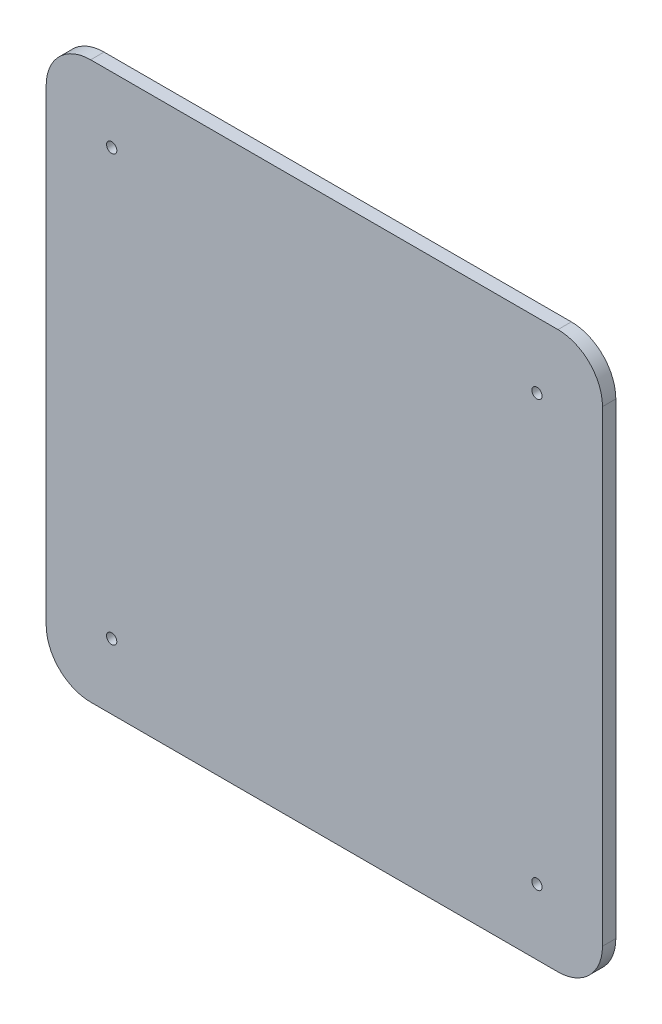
SolidWorks part; units mm, degrees
ref_plane "Alzado" through (0, 0, 0) normal (0, 0, 1) x (1, 0, 0)
ref_plane "Planta" through (0, 0, 0) normal (0, 1, 0) x (1, 0, 0)
ref_plane "Vista lateral" through (0, 0, 0) normal (1, 0, 0) x (0, 0, -1)
sketch "Croquis1" plane through (0, 0, 0) normal (0, 0, 1) x (1, 0, 0)
  line L1 (125, 0) -> (0, 0) construction
  line L2 (125, 0) -> (125, 125) construction
  line L5 (125, 125) -> (0, 125)
  line L17 (125, 0) -> (125, 125) construction
  line L147 (125, 0) -> (125, 125)
  line L153 (0, 125) -> (0, 0)
  line L163 (0, 0) -> (125, 0) construction
  line L165 (0, 0) -> (125, 0)
  dimension "width" = 125
extrude "Saliente-Extruir1" add sketch "Croquis1" along normal blind 3
sketch "Croquis2" plane through (0, 0, 3) normal (0, 0, 1) x (1, 0, 0)
  line L0 (0, 240) -> (90, 150) construction
  circle A0 centre (45, 195) radius 27.5
  dimension "D1" = 55
extrude "Cortar-Extruir1" [suppressed] cut sketch "Croquis2" against normal up to surface (3 mm away)
fillet "Redondeo1" radius 10 4 edges at (0, 0, 1.5) (125, 0, 1.5) (0, 125, 1.5) (125, 125, 1.5)
sketch "Croquis4" [suppressed] plane through (0, 0, 3) normal (0, 0, 1) x (1, 0, 0)
  line L21 (117.35, 10) -> (117.35, 115) construction
  line L22 (115, 117.35) -> (93.7953, 117.35) construction
  line L23 (83.5365, 120.6376) -> (82.8932, 121.0971) construction
  line L81 (77.8667, 144.2845) -> (82.0352, 151.5045) construction
  line L112 (82.35, 152.6795) -> (82.35, 230) construction
  line L121 (80, 232.35) -> (10, 232.35) construction
  line L122 (7.65, 230) -> (7.65, 10) construction
  line L123 (10, 7.65) -> (115, 7.65) construction
  line L124 (0, 115) -> (0, 10) construction
  line L129 (20, 7.65) -> (40, 7.65)
  line L130 (20, 7.65) -> (20, 5)
  line L131 (20, 5) -> (40, 5)
  line L132 (40, 7.65) -> (40, 5)
  line L133 (62.5, 5) -> (62.5, 120) construction
  line L134 (117.35, 62.5) -> (38.0325, 62.5) construction
  line L135 (7.65, 120) -> (68.1686, 120) construction
  line L136 (120, 10) -> (120, 115)
  line L153 (115, 120) -> (10, 120)
  line L154 (115, 120) -> (10, 120)
  line L252 (5, 115) -> (5, 10)
  line L265 (10, 5) -> (115, 5)
  line L266 (120, 10) -> (120, 115) construction
  line L272 (5, 115) -> (5, 10) construction
  line L273 (10, 5) -> (115, 5) construction
  line L274 (45, 232.35) -> (45, 294.3114) construction
  line L275 (85, 7.65) -> (85, 5)
  line L276 (105, 5) -> (85, 5)
  line L277 (105, 7.65) -> (105, 5)
  line L304 (105, 7.65) -> (85, 7.65)
  line L305 (117.35, 105) -> (117.35, 85)
  line L306 (120, 20) -> (117.35, 20)
  line L307 (120, 20) -> (120, 40)
  line L308 (120, 40) -> (117.35, 40)
  line L309 (117.35, 20) -> (117.35, 40)
  line L310 (120, 85) -> (117.35, 85)
  line L311 (120, 105) -> (120, 85)
  line L312 (120, 105) -> (117.35, 105)
  line L313 (120, 20) -> (120, 0) construction
  line L315 (115, 0) -> (120, 0) construction
  line L316 (20, 5) -> (0, 5) construction
  line L317 (0, 5) -> (0, 10) construction
  line L319 (7.65, 20) -> (7.65, 0) construction
  line L320 (5, 20) -> (7.65, 20)
  line L321 (5, 20) -> (5, 40)
  line L322 (5, 40) -> (7.65, 40)
  line L323 (7.65, 20) -> (7.65, 40)
  line L324 (7.65, 0) -> (10, 0) construction
  line L325 (10, 0) -> (115, 0) construction
  line L326 (72.5, 195) -> (17.5, 195) construction
  line L327 (7.65, 160) -> (72.65, 160) construction
  line L328 (7.65, 160) -> (7.65, 110) construction
  line L329 (7.65, 110) -> (72.65, 110) construction
  line L330 (72.65, 160) -> (72.65, 110) construction
  line L331 (7.65, 105) -> (7.65, 85)
  line L332 (5, 85) -> (7.65, 85)
  line L333 (5, 105) -> (5, 85)
  line L334 (5, 105) -> (7.65, 105)
  line L335 (72.65, 160) -> (7.65, 110) construction
  line L336 (40, 117.35) -> (40, 120)
  line L337 (20, 120) -> (40, 120)
  line L338 (20, 117.35) -> (20, 120)
  line L339 (20, 117.35) -> (40, 117.35)
  line L340 (105, 117.35) -> (85, 117.35)
  line L341 (105, 117.35) -> (105, 120)
  line L342 (105, 120) -> (85, 120)
  line L343 (85, 117.35) -> (85, 120)
  line L346 (115, 120) -> (93.7953, 120) construction
  line L347 (85.0768, 122.794) -> (84.4335, 123.2535) construction
  line L348 (80.1617, 142.9595) -> (84.3301, 150.1795) construction
  line L349 (85, 152.6795) -> (85, 230) construction
  line L350 (80, 235) -> (10, 235) construction
  arc A0 (117.35, 115) -> (115, 117.35) centre (115, 115) ccw construction
  arc A1 (83.5365, 120.6376) -> (93.7953, 117.35) centre (93.7953, 135) ccw construction
  arc A2 (77.8667, 144.2845) -> (82.8932, 121.0971) centre (93.152, 135.4595) ccw construction
  arc A3 (82.0352, 151.5045) -> (82.35, 152.6795) centre (80, 152.6795) ccw construction
  arc A4 (82.35, 230) -> (80, 232.35) centre (80, 230) ccw construction
  arc A5 (10, 232.35) -> (7.65, 230) centre (10, 230) ccw construction
  arc A6 (7.65, 10) -> (10, 7.65) centre (10, 10) ccw construction
  arc A7 (115, 7.65) -> (117.35, 10) centre (115, 10) ccw construction
  arc A8 (0, 10) -> (10, 0) centre (10, 10) ccw construction
  circle A9 centre (45, 195) radius 27.5 construction
  arc A15 (10, 120) -> (5, 115) centre (10, 115) ccw
  arc A16 (10, 120) -> (5, 115) centre (10, 115) ccw
  arc A17 (120, 115) -> (115, 120) centre (115, 115) ccw
  arc A18 (120, 115) -> (115, 120) centre (115, 115) ccw
  arc A23 (5, 10) -> (10, 5) centre (10, 10) ccw
  arc A40 (115, 5) -> (120, 10) centre (115, 10) ccw
  arc A47 (5, 10) -> (10, 5) centre (10, 10) ccw construction
  arc A49 (115, 5) -> (120, 10) centre (115, 10) ccw construction
  arc A50 (120, 115) -> (115, 120) centre (115, 115) ccw construction
  arc A51 (85.0768, 122.794) -> (93.7953, 120) centre (93.7953, 135) ccw construction
  arc A52 (80.1617, 142.9595) -> (84.4335, 123.2535) centre (93.152, 135.4595) ccw construction
  arc A53 (84.3301, 150.1795) -> (85, 152.6795) centre (80, 152.6795) ccw construction
  arc A54 (85, 230) -> (80, 235) centre (80, 230) ccw construction
  arc A55 (10, 235) -> (5, 115) centre (10, 230) ccw construction
  point P34 (20, 6.325)
  dimension "D3" = 20
  dimension "D5" = 50
  dimension "D4" = 20
  dimension "D6" = 65
  dimension "D7" = 35
  dimension "D1" = 5
  dimension "D2" = 2.65
extrude "Cortar-Extruir2" [suppressed] cut sketch "Croquis4" against normal up to surface (3 mm away)
sketch "Croquis5" plane through (0, 0, 3) normal (0, 0, 1) x (1, 0, 0)
  line L0 (7.65, 117.35) -> (117.35, 7.65) construction
  line L1 (117.35, 7.65) -> (117.35, 117.35) construction
  line L2 (117.35, 117.35) -> (7.65, 7.65) construction
  line L3 (110.2789, 110.2789) -> (117.35, 117.35) construction
  line L4 (7.65, 117.35) -> (14.7211, 110.2789) construction
  line L5 (110.2789, 14.7211) -> (117.35, 7.65) construction
  line L6 (7.65, 7.65) -> (14.7211, 14.7211) construction
  line L7 (117.35, 7.65) -> (110.2789, 14.7211) construction
  line L8 (7.65, 117.35) -> (117.35, 117.35) construction
  line L9 (14.7211, 110.2789) -> (40.1205, 110.2789) construction
  circle A0 centre (14.7211, 110.2789) radius 1.15
  circle A1 centre (110.2789, 14.7211) radius 1.15
  circle A2 centre (110.2789, 110.2789) radius 1.15
  circle A3 centre (14.7211, 14.7211) radius 1.15
  dimension "D1" = 2.3
  dimension "D2" = 10
extrude "Cortar-Extruir3" cut sketch "Croquis5" against normal up to surface (3 mm away)
sketch "Croquis6" plane through (0, 0, 0) normal (0, 0, -1) x (-1, 0, 0)
  line L0 (-92.5, 0) -> (-92.5, 117.5) construction
  line L1 (-10, 0) -> (-115, 0) construction
  line L2 (-97.5, 35) -> (-87.5, 35) construction
  line L3 (-97.5, 35) -> (-97.5, 20) construction
  line L4 (-87.5, 35) -> (-87.5, 20) construction
  line L5 (-97.5, 20) -> (-87.5, 20) construction
  line L6 (-97.5, 35) -> (-87.5, 20) construction
  line L7 (-87.5, 35) -> (-97.5, 20) construction
  line L8 (-57.5, 35) -> (-67.5, 20) construction
  line L9 (-125, 10) -> (-125, 115) construction
  line L10 (-72.5, 35) -> (-72.5, 20) construction
  line L11 (-82.5, 35) -> (-72.5, 35) construction
  line L12 (-82.5, 35) -> (-82.5, 20) construction
  line L13 (-82.5, 20) -> (-72.5, 20) construction
  line L14 (-57.5, 35) -> (-57.5, 20) construction
  line L15 (-67.5, 35) -> (-57.5, 35) construction
  line L16 (-67.5, 35) -> (-67.5, 20) construction
  line L17 (-67.5, 20) -> (-57.5, 20) construction
  line L18 (-72.5, 35) -> (-82.5, 20) construction
  line L19 (-87.5, 35) -> (-72.5, 35) construction
  circle A1 centre (-92.5, 27.5) radius 5
  circle A2 centre (-77.5, 27.5) radius 5
  circle A4 centre (-62.5, 27.5) radius 5
  point P5 (-92.5, 27.5)
  dimension "D1" = 32.5
  dimension "D2" = 15
  dimension "D3" = 10
  dimension "D4" = 20
  dimension "D6" = 15
  dimension "D5" = 3
extrude "Cortar-Extruir4" [suppressed] cut sketch "Croquis6" against normal up to surface (3 mm away)
sketch "Croquis8" [suppressed] plane through (0, 0, 0) normal (0, 0, -1) x (-1, 0, 0)
  line L0 (-45, 195) -> (-45, 120) construction
  line L1 (-20, 120) -> (-40, 120) construction
  line L3 (-40, 120) -> (-20, 120) construction
  circle A0 centre (-45, 145) radius 5
  dimension "D1" = 10
  dimension "D2" = 25
extrude "Cortar-Extruir5" [suppressed] cut sketch "Croquis8" against normal up to surface (3 mm away)
sketch "Croquis9" plane through (0, 0, 0) normal (0, 0, -1) x (-1, 0, 0)
  circle A0 centre (-55.5, 34.5) radius 1.55
  circle A1 centre (-99.5, 20.5) radius 1.55
  dimension "D1" = 3.1
extrude "Cortar-Extruir6" [suppressed] cut sketch "Croquis9" against normal up to next
